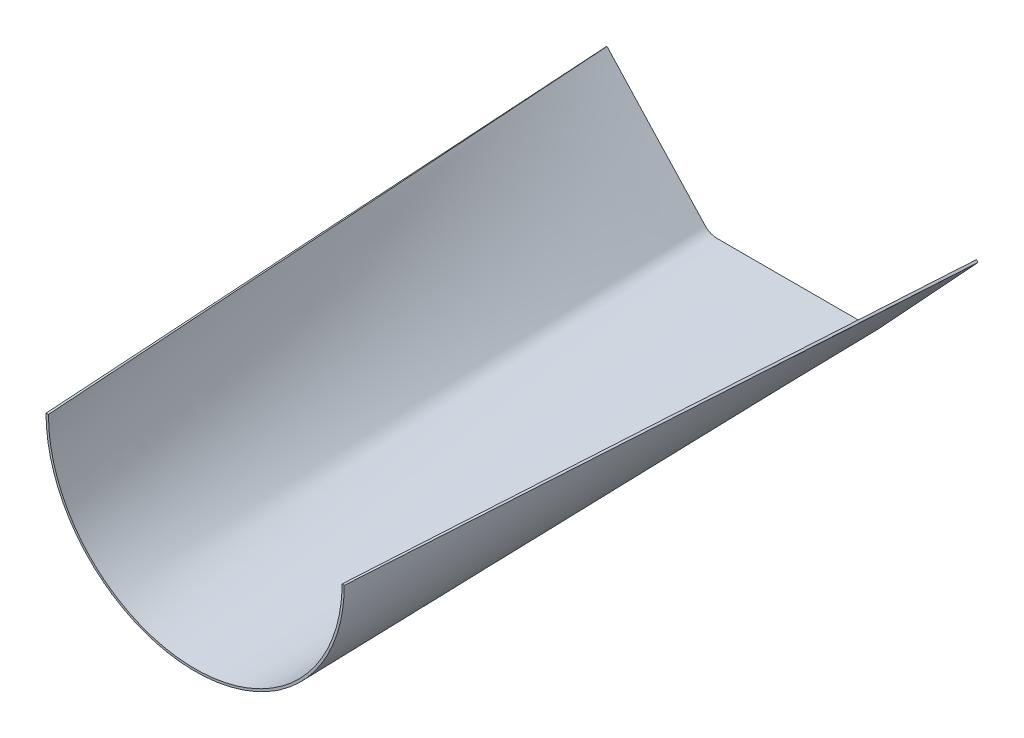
SolidWorks part; units mm, degrees
ref_plane "Front" through (0, 0, 0) normal (0, 0, 1) x (1, 0, 0)
ref_plane "Top" through (0, 0, 0) normal (0, 1, 0) x (1, 0, 0)
ref_plane "Right" through (0, 0, 0) normal (1, 0, 0) x (0, 0, -1)
sketch "Inlet" plane through (0, 0, 0) normal (0, 0, 1) x (1, 0, 0)
  line L0 (-127, 0) -> (-60.1126, -72.1351)
  line L1 (-50.8, -76.2) -> (50.8, -76.2)
  line L2 (60.1126, -72.1351) -> (127, 0)
  arc A0 (50.8, -76.2) -> (60.1126, -72.1351) centre (50.8, -63.5) ccw
  arc A1 (-60.1126, -72.1351) -> (-50.8, -76.2) centre (-50.8, -63.5) ccw
  point P4 (0, -76.2)
  dimension "CornerRadius" = 12.7
  dimension "Depth" = 76.2
  dimension "VeeWidth" = 254
  dimension "TrayWidth" = 101.6
ref_plane "ExitPlane" through (0, 0, 406.4) normal (0, 0, 1) x (1, 0, 0)
sketch "Outlet" plane through (0, 0, 406.4) normal (0, 0, 1) x (1, 0, 0)
  arc A0 (-101.6, 0) -> (101.6, 0) centre (0, 0) ccw
  dimension "Width" = 203.2
sheet metal parameters "Sheet-Metal1" thickness 1.5875 parameters "D1"=0.7366
lofted bend "Transition" parameters "D1"=0, "D12"=1
other "Freeform Bend1" parameters "D1"=1000, "D4"=57.296, "D5"=1
flat pattern "Flat-Pattern1"
sketch "Bend-Lines1" plane through (0, 0, 0) normal (0, 1, 0) x (-1, 0, 0)
other "Flatten-<Freeform Bend1>1"
